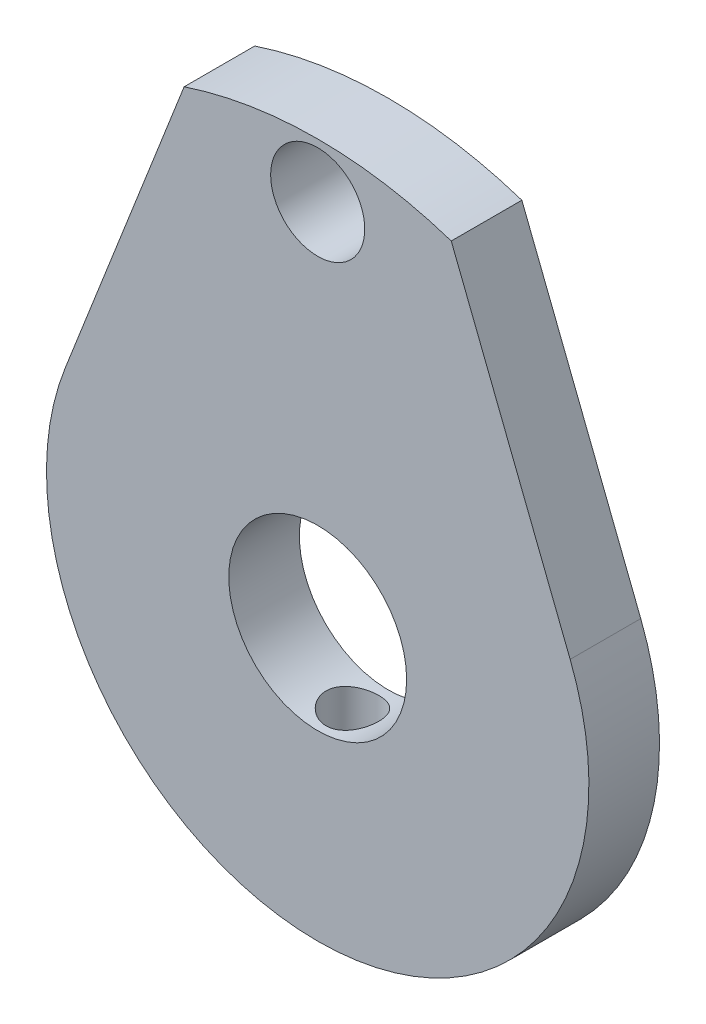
SolidWorks part; units mm, degrees
ref_plane "Front" through (0, 0, 0) normal (0, 0, 1) x (1, 0, 0)
ref_plane "Top" through (0, 0, 0) normal (0, 1, 0) x (1, 0, 0)
ref_plane "Right" through (0, 0, 0) normal (1, 0, 0) x (0, 0, -1)
sketch "Sketch1" plane through (0, 0, 0) normal (0, 0, 1) x (1, 0, 0)
  circle A0 centre (0, 0) radius 14.2875
  dimension "D1" = 28.575
extrude "Extrude1" add sketch "Sketch1" along normal blind 2.3813
sketch "Sketch2" plane through (0, 0, 0) normal (0, 0, -1) x (-1, 0, 0)
  circle A0 centre (0, 12.446) radius 1.5875
  dimension "D1" = 3.175
  dimension "D2" = 12.446
extrude "Cut-Extrude1" cut sketch "Sketch2" against normal through all
sketch "Sketch3" plane through (0, 0, 0) normal (0, 0, -1) x (-1, 0, 0)
  circle A0 centre (0, 0) radius 6.6294
  dimension "D1" = 13.2588
extrude "Cut-Extrude2" [suppressed] cut sketch "Sketch3" against normal blind 0.4318
sketch "Sketch4" plane through (0, 0, 2.3813) normal (0, 0, 1) x (1, 0, 0)
  line L0 (-4.5047, 13.5588) -> (-8.5151, 3.3426)
  line L1 (4.5047, 13.5588) -> (8.5151, 3.3426)
  line L2 (-9.8273, 0) -> (9.8273, 0) construction
  line L3 (-4.5047, 13.5588) -> (4.5047, 13.5588) construction
  circle A0 centre (0, 0) radius 14.2875 construction
  arc A1 (-8.5151, 3.3426) -> (8.5151, 3.3426) centre (0, 0) ccw
  arc A2 (4.5047, 13.5588) -> (-4.5047, 13.5588) centre (0, 0) ccw
  point P10 (0, 0)
  point P11 (0, 13.5588)
extrude "Cut-Extrude3" cut sketch "Sketch4" against normal through all flip side to cut
hole_wizard "#52 (0.063500) Diameter Hole1" positions "Sketch6" profile "Sketch5" hole size "#52" standard "Ansi Inch"
sketch "Sketch6" plane through (0, 0, 2.3813) normal (0, 0, 1) x (1, 0, 0)
  point P0 (-2.54, -0.889)
  point P1 (2.54, -0.889)
  dimension "D1" = 2.54
  dimension "D2" = 5.08
  dimension "D3" = 0.889
  dimension "D4" = 0.889
sketch "Sketch5" plane through (-2.54, -0.889, 2.3813) normal (1, 0, 0) x (0, -1, 0)
  line L0 (0, 0) -> (0, 2.3813)
  line L1 (0, 2.3813) -> (0.8064, 2.3813)
  line L2 (0.8064, 2.3813) -> (0.8064, 0)
  line L5 (0.8064, 0) -> (0, 0)
  line L11 (0, -6.35) -> (0, 107.95) construction
  dimension "Thru Hole Dia." = 1.6129
  dimension "Thru Hole Depth" = 2.3813
sketch "Sketch7" [suppressed] plane through (0, 0, 2.3813) normal (0, 0, 1) x (1, 0, 0)
  line L0 (-1.9701, -1.8332) -> (-2.6833, 0.2046) construction
  line L1 (0, 0) -> (-2.54, -0.889) construction
  arc A0 (-1.8792, 0.1433) -> (-1.3797, -1.2839) centre (0, 0) ccw
  arc A1 (-3.4874, 0.2659) -> (-2.5605, -2.3826) centre (0, 0) ccw
  circle A2 centre (-2.54, -0.889) radius 0.8064 construction
  circle A3 centre (0, 0) radius 6.6294 construction
  arc A4 (-2.5605, -2.3826) -> (-1.3797, -1.2839) centre (-1.9701, -1.8332) ccw
  arc A5 (-1.8792, 0.1433) -> (-3.4874, 0.2659) centre (-2.6833, 0.2046) ccw
  point P12 (-2.3267, -0.8143)
  dimension "D1" = 2.159
extrude "Cut-Extrude4" [suppressed] cut sketch "Sketch7" against normal through all
mirror "Mirror1" [suppressed] about plane through (0, 0, 0) normal (1, 0, 0)
sketch "Sketch8" plane through (0, 0, 2.3813) normal (0, 0, 1) x (1, 0, 0)
  circle A0 centre (0, 0) radius 3
  dimension "D1" = 6
extrude "Cut-Extrude5" cut sketch "Sketch8" against normal through all
ref_plane "Plane1" through (0, -9.1477, 0) normal (0, 1, 0) x (-1, 0, 0)
sketch "Sketch9" plane through (0, -9.1477, 0) normal (0, 1, 0) x (-1, 0, 0)
  circle A0 centre (0, 1.2078) radius 0.889
  dimension "D1" = 1.778
extrude "Cut-Extrude7" cut sketch "Sketch9" along normal blind 0.254
hole_wizard "#2-56 Tapped Hole1" positions "3DSketch1" profile "Sketch10" tap size "#2-56" standard "Ansi Inch"
sketch3d "3DSketch1"
  line L0 (0, -8.8937, 1.2078) -> (0, -9.1477, 1.2078) construction
  point P0 (0, -8.8937, 1.2078)
sketch "Sketch10" plane through (0, -8.8937, 1.2078) normal (1, 0, 0) x (0, 0, -1)
  line L0 (0, 0) -> (0, 5.8937)
  line L1 (0, 5.8937) -> (0.889, 5.8937)
  line L2 (0.889, 5.8937) -> (0.889, 0)
  line L5 (0.889, 0) -> (0, 0)
  line L11 (0, -6.35) -> (0, 107.95) construction
  dimension "Thru Tap Drill Dia." = 1.778
  dimension "Thru Tap Drill Depth" = 5.8937
